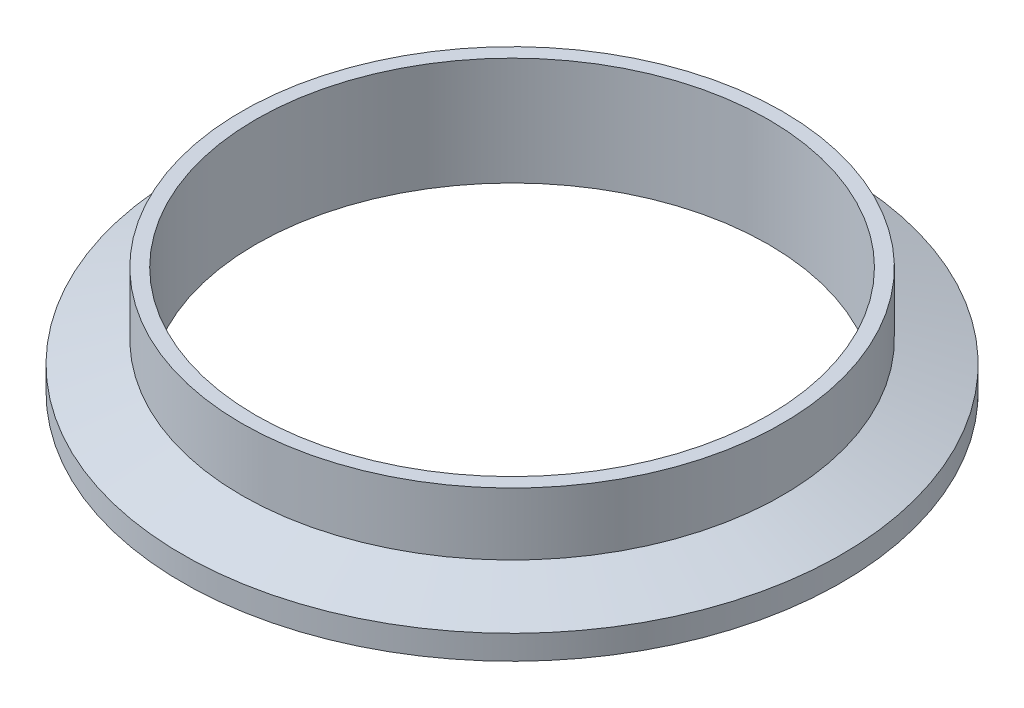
SolidWorks part; units mm, degrees
ref_plane "Front Plane" through (0, 0, 0) normal (0, 0, 1) x (1, 0, 0)
ref_plane "Top Plane" through (0, 0, 0) normal (0, 1, 0) x (1, 0, 0)
ref_plane "Right Plane" through (0, 0, 0) normal (1, 0, 0) x (0, 0, -1)
sketch "Sketch1" plane through (0, 0, 0) normal (0, 0, 1) x (1, 0, 0)
  line L0 (0, 0) -> (0, 12.7) construction
  line L1 (0, 12.7) -> (-31.75, 12.7)
  line L2 (-31.75, 12.7) -> (-31.75, 5.3779)
  line L3 (-31.75, 5.3779) -> (-38.7096, 2.8448)
  line L4 (-38.7096, 2.8448) -> (-38.7096, 0)
  line L5 (-38.7096, 0) -> (-37.1367, 0)
  line L6 (-33.5007, 0) -> (0, 0)
  line L7 (0, 0) -> (0, 12.7)
  line L8 (0, 12.7) -> (-30.099, 12.7)
  line L9 (-30.099, 12.7) -> (-30.099, 0)
  line L10 (-30.099, 0) -> (0, 0)
  line L11 (0, 0) -> (-0.1846, 0.0129)
  arc A0 (-36.4142, 0.4745) -> (-34.2232, 0.4745) centre (-35.3187, 0) cw
  arc A1 (-33.5007, 0) -> (-34.2232, 0.4745) centre (-33.5007, 0.7874) cw
  arc A2 (-36.4142, 0.4745) -> (-37.1367, 0) centre (-37.1367, 0.7874) cw
  point P12 (-34.1249, 0)
  dimension "D6" = 1.1938
  dimension "D7" = 0.7874
  dimension "D1" = 31.75
  dimension "D2" = 2.8448
  dimension "D3" = 38.7096
  dimension "D4" = 70
  dimension "D5" = 35.3187
  dimension "D8" = 1.651
  dimension "D9" = 12.7
revolve "Revolve2" add sketch "Sketch1" angle 360 about L0
